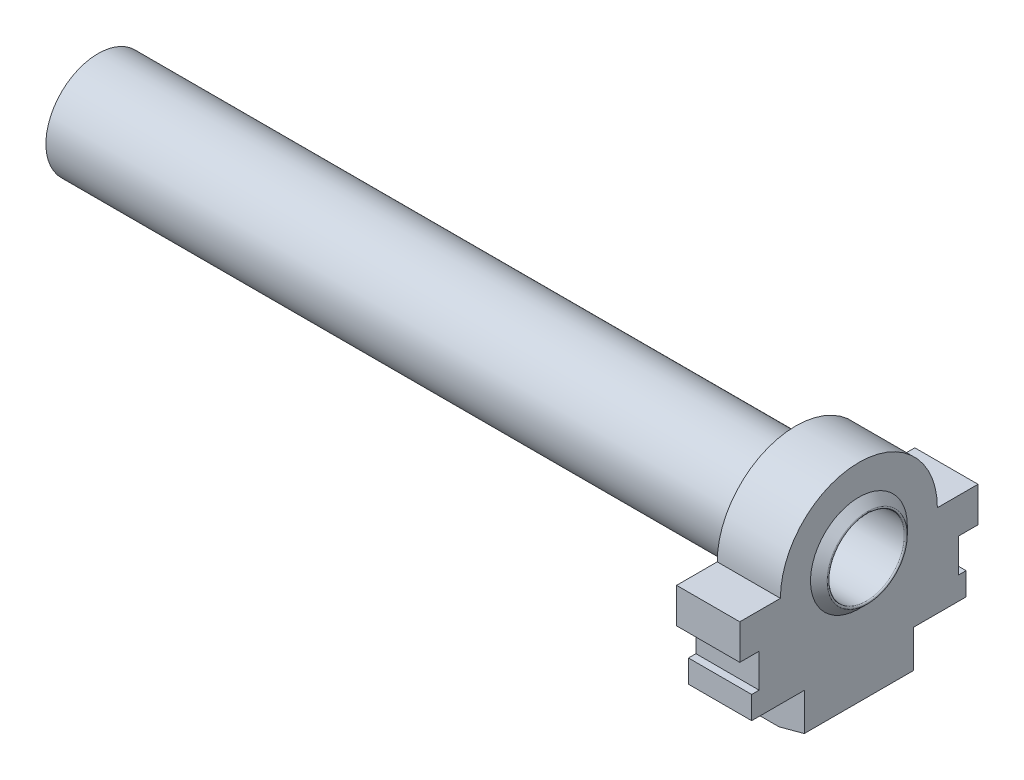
SolidWorks part; units mm, degrees
ref_plane "Front Plane" through (0, 0, 0) normal (0, 0, 1) x (1, 0, 0)
ref_plane "Top Plane" through (0, 0, 0) normal (0, 1, 0) x (1, 0, 0)
ref_plane "Right Plane" through (0, 0, 0) normal (1, 0, 0) x (0, 0, -1)
sketch "Sketch1" plane through (0, 0, 0) normal (1, 0, 0) x (0, 0, -1)
  line L0 (5.4864, -15.5561) -> (-5.4864, -15.5561)
  line L1 (0, 16.9749) -> (0, -25.4624) construction
  line L2 (-7.8867, -1.9036) -> (-11.9697, -1.9036)
  line L3 (-11.9697, -1.9036) -> (-11.9697, -5.4342)
  line L4 (-11.9697, -5.4342) -> (-10.0275, -5.4342)
  line L5 (-10.7759, -11.1111) -> (-10.7759, -8.8251)
  line L6 (-10.7759, -8.8251) -> (-10.0275, -8.8251)
  line L7 (-10.0275, -8.8251) -> (-10.0275, -5.4342)
  line L8 (-10.7759, -11.1111) -> (-5.4864, -11.1111)
  line L9 (-5.4864, -11.1111) -> (-5.4864, -15.5561)
  line L10 (5.4864, -11.1111) -> (5.4864, -15.5561)
  line L11 (10.7759, -11.1111) -> (5.4864, -11.1111)
  line L12 (10.0275, -8.8251) -> (10.0275, -5.4342)
  line L13 (10.7759, -8.8251) -> (10.0275, -8.8251)
  line L14 (10.7759, -11.1111) -> (10.7759, -8.8251)
  line L15 (11.9697, -5.4342) -> (10.0275, -5.4342)
  line L16 (11.9697, -1.9036) -> (11.9697, -5.4342)
  line L17 (7.8867, -1.9036) -> (11.9697, -1.9036)
  circle A0 centre (0, -1.9036) radius 3.81
  arc A1 (7.8867, -1.9036) -> (-7.8867, -1.9036) centre (0, -1.9036) ccw
  point P8 (0, 5.9831)
  point P25 (0, -15.5561)
  dimension "D1" = 7.62
  dimension "D3" = 15.7734
  dimension "D2" = 5.4864
  dimension "D4" = 21.5392
  dimension "D5" = 11.9697
  dimension "D6" = 10.7759
  dimension "D7" = 4.445
  dimension "D8" = 2.286
  dimension "D9" = 3.3909
extrude "Boss-Extrude1" add sketch "Sketch1" along normal blind 77.724
sketch "Sketch2" plane through (0, 0, 0) normal (1, 0, 0) x (0, 0, -1)
  line L1 (16.8212, 10.9942) -> (-19.9426, 10.9942)
  line L2 (16.8212, 10.9942) -> (16.8212, -18.5729)
  line L3 (16.8212, -18.5729) -> (-19.9426, -18.5729)
  line L4 (-19.9426, 10.9942) -> (-19.9426, -18.5729)
  circle A0 centre (0, -1.9036) radius 3.81 construction
  circle A1 centre (0, -1.9036) radius 3.81
  circle A2 centre (0, -1.9036) radius 5.2451
  dimension "D1" = 10.4902
sketch "Sketch3" plane through (0, 0, 0) normal (1, 0, 0) x (0, 0, -1)
  circle A0 centre (0, -1.9036) radius 3.81 construction
  circle A1 centre (0, -1.9036) radius 3.81
extrude "Boss-Extrude2" add sketch "Sketch3" along normal blind 6.35
ref_plane "Plane1" through (77.724, 0, 0) normal (1, 0, 0) x (0, 0, -1)
sketch "Sketch4" plane through (77.724, 0, 0) normal (1, 0, 0) x (0, 0, -1)
  line L17 (-5.4864, -11.1111) -> (-5.4864, -15.5561)
  line L18 (-5.4864, -15.5561) -> (5.4864, -15.5561)
  line L19 (5.4864, -15.5561) -> (5.4864, -11.1111)
  line L20 (5.4864, -11.1111) -> (10.7759, -11.1111)
  line L21 (10.7759, -11.1111) -> (10.7759, -8.8251)
  line L22 (10.7759, -8.8251) -> (10.0275, -8.8251)
  line L23 (10.0275, -8.8251) -> (10.0275, -5.4342)
  line L24 (10.0275, -5.4342) -> (11.9697, -5.4342)
  line L25 (11.9697, -5.4342) -> (11.9697, -1.9036)
  line L26 (11.9697, -1.9036) -> (7.8867, -1.9036)
  line L27 (-7.8867, -1.9036) -> (-11.9697, -1.9036)
  line L28 (-11.9697, -1.9036) -> (-11.9697, -5.4342)
  line L29 (-11.9697, -5.4342) -> (-10.0275, -5.4342)
  line L30 (-10.0275, -5.4342) -> (-10.0275, -8.8251)
  line L31 (-10.0275, -8.8251) -> (-10.7759, -8.8251)
  line L32 (-10.7759, -8.8251) -> (-10.7759, -11.1111)
  line L33 (-10.7759, -11.1111) -> (-5.4864, -11.1111)
  line L34 (-5.4864, -11.1111) -> (-5.4864, -15.5561)
  line L35 (-5.4864, -15.5561) -> (5.4864, -15.5561)
  line L36 (5.4864, -15.5561) -> (5.4864, -11.1111)
  line L37 (5.4864, -11.1111) -> (10.7759, -11.1111)
  line L38 (10.7759, -11.1111) -> (10.7759, -8.8251)
  line L39 (10.7759, -8.8251) -> (10.0275, -8.8251)
  line L40 (10.0275, -8.8251) -> (10.0275, -5.4342)
  line L41 (10.0275, -5.4342) -> (11.9697, -5.4342)
  line L42 (11.9697, -5.4342) -> (11.9697, -1.9036)
  line L43 (11.9697, -1.9036) -> (7.8867, -1.9036)
  line L44 (-7.8867, -1.9036) -> (-11.9697, -1.9036)
  line L45 (-11.9697, -1.9036) -> (-11.9697, -5.4342)
  line L46 (-11.9697, -5.4342) -> (-10.0275, -5.4342)
  line L47 (-10.0275, -5.4342) -> (-10.0275, -8.8251)
  line L48 (-10.0275, -8.8251) -> (-10.7759, -8.8251)
  line L49 (-10.7759, -8.8251) -> (-10.7759, -11.1111)
  line L50 (-10.7759, -11.1111) -> (-5.4864, -11.1111)
  circle A0 centre (0, -1.9036) radius 3.81 construction
  arc A1 (7.8867, -1.9036) -> (-7.8867, -1.9036) centre (0, -1.9036) ccw
  arc A2 (7.8867, -1.9036) -> (-7.8867, -1.9036) centre (0, -1.9036) ccw
  circle A3 centre (0, -1.9036) radius 3.81
  circle A4 centre (0, -1.9036) radius 4.8622
  dimension "D1" = 0
extrude "Cut-Extrude2" cut sketch "Sketch2" along normal blind 70.104 contours L1 L4 L3 L2 A2
extrude "Cut-Extrude3" cut sketch "Sketch4" against normal blind 1.27 contours L43 A2 L44 L45 L46 L47 L48 L49 L50 L34 L35 L36 L37 L38 L39 L40 L41 L42 A4
chamfer "Chamfer1" distance 1.27 angle 45 1 edges at (77.724, -1.9036, -4.8622)
fillet "Fillet1" radius 0.127 1 edges at (77.5062, -1.9036, 3.81)
chamfer "Chamfer2" distance 2.54 angle 15 1 edges at (76.454, -15.5561, 0)
